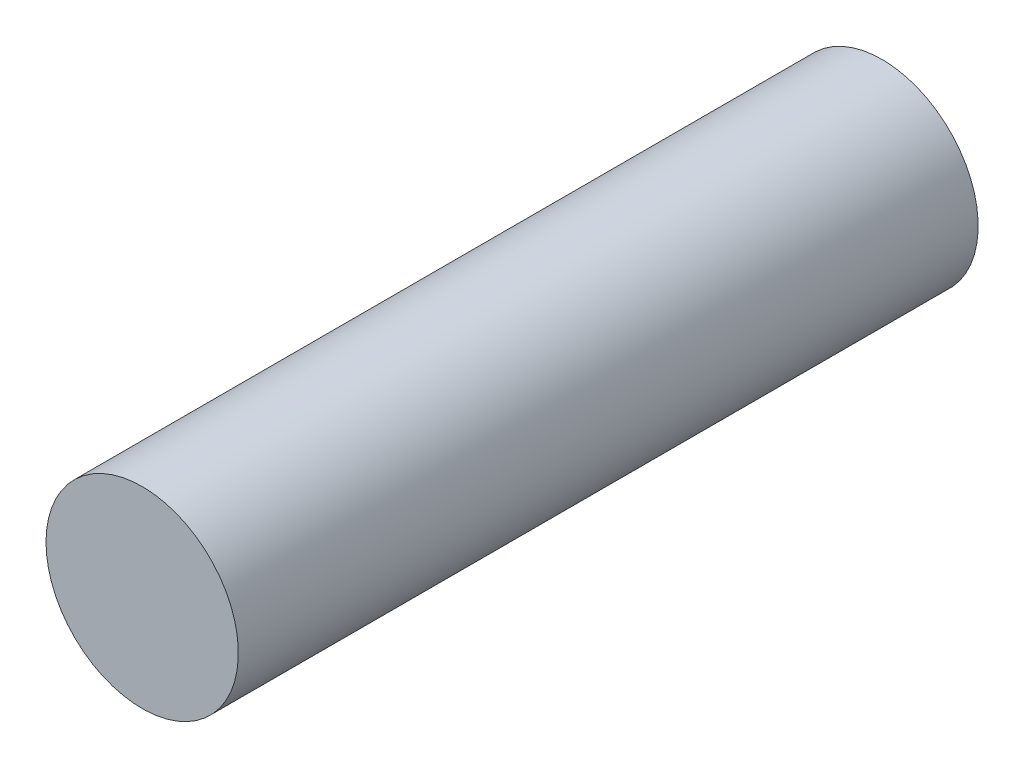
SolidWorks part; units mm, degrees
ref_plane "Plane1" through (0, 0, 0) normal (0, 0, 1) x (1, 0, 0)
ref_plane "Plane2" through (0, 0, 0) normal (0, 1, 0) x (1, 0, 0)
ref_plane "Plane3" through (0, 0, 0) normal (1, 0, 0) x (0, 0, -1)
sketch "Sketch1" plane through (0, 0, 0) normal (0, 0, 1) x (1, 0, 0)
  circle A0 centre (0, 0) radius 1.9812
  dimension "D1" = 3.9624
extrude "Base-Extrude" add sketch "Sketch1" along normal blind 15.24
